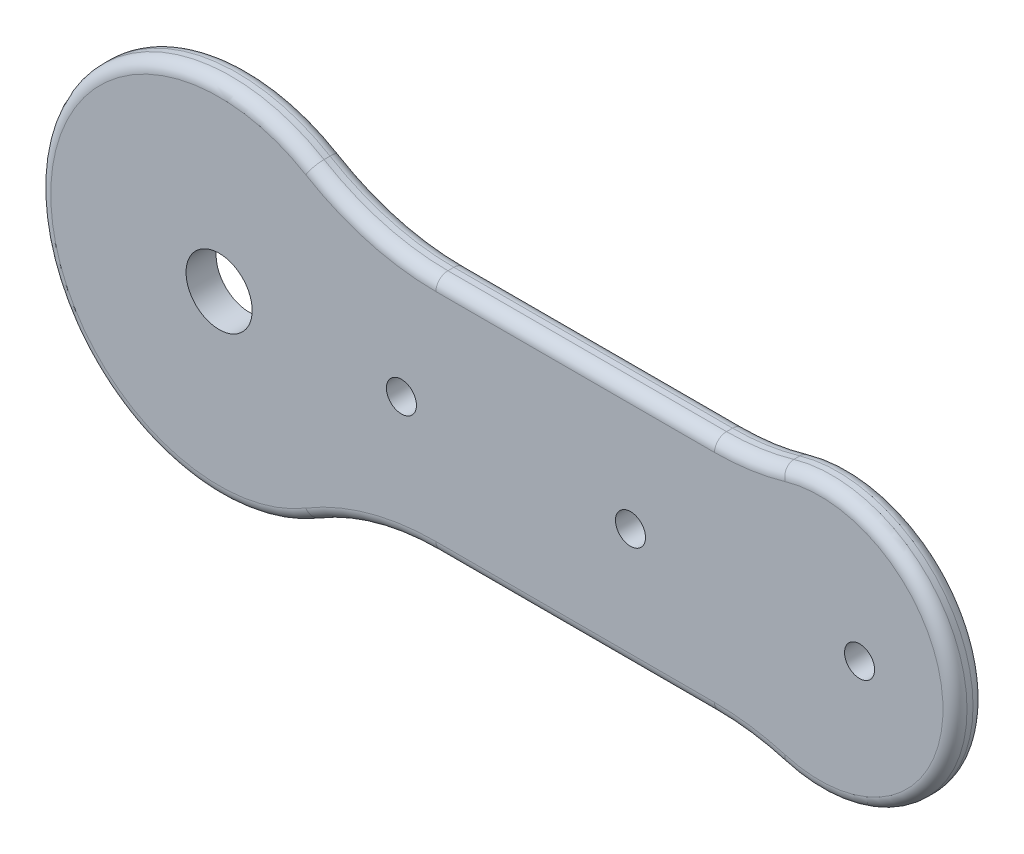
SolidWorks part; units mm, degrees
ref_plane "Front Plane" through (0, 0, 0) normal (0, 0, 1) x (1, 0, 0)
ref_plane "Top Plane" through (0, 0, 0) normal (0, 1, 0) x (1, 0, 0)
ref_plane "Right Plane" through (0, 0, 0) normal (1, 0, 0) x (0, 0, -1)
sketch "Sketch1" plane through (0, 0, 0) normal (0, 0, 1) x (1, 0, 0)
  line L1 (-99.9, 40) -> (99.9, 40)
  line L2 (-99.9, 40) -> (-99.9, -40)
  line L3 (-99.9, -40) -> (99.9, -40)
  line L4 (99.9, 40) -> (99.9, -40)
  line L5 (-99.9, 40) -> (99.9, -40) construction
  line L6 (-99.9, -40) -> (99.9, 40) construction
  circle A0 centre (99.9, 0) radius 45
  circle A1 centre (-99.9, 0) radius 60
  circle A2 centre (-99.9, 0) radius 11
  circle A4 centre (36.95, 0) radius 5
  circle A5 centre (-39.25, 0) radius 5
  circle A7 centre (113.15, 0) radius 5
  point P0 (0, 0)
  point P18 (-159.9, 0)
  point P19 (144.9, 0)
  dimension "D2" = 120
  dimension "D3" = 90
  dimension "D5" = 22
  dimension "D6" = 10
  dimension "D7" = 10
  dimension "D8" = 10
  dimension "D10" = 31.75
  dimension "D11" = 76.2
  dimension "D12" = 76.2
  dimension "D1" = 80
  dimension "D4" = 304.8
extrude "Boss-Extrude1" add sketch "Sketch1" along normal blind 10
fillet "Fillet1" radius 80 4 edges at (-55.1786, -40, 5) (-55.1786, 40, 5) (79.2845, -40, 5) (79.2845, 40, 5)
fillet "Fillet2" radius 4 16 edges at (18.5555, 40, 0) (18.5555, 40, 10) (-159.9, 0, 0) (-159.9, 0, 10) (18.5555, -40, 10) (18.5555, -40, 0) (144.9, 0, 10) (144.9, 0, 0) (-49.1699, -42.9101, 10) (-49.1699, -42.9101, 0) (-49.1699, 42.9101, 10) (-49.1699, 42.9101, 0) (76.2137, -40.804, 10) (76.2137, -40.804, 0) (76.2137, 40.804, 10) (76.2137, 40.804, 0)
